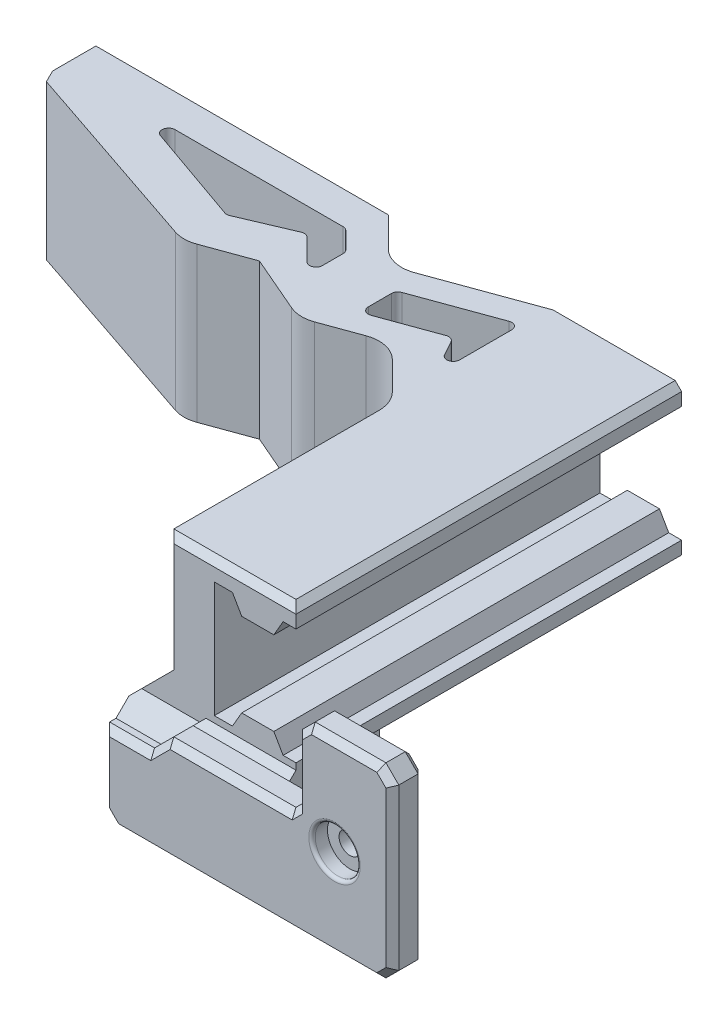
SolidWorks part; units mm, degrees
ref_plane "Płaszczyzna przednia" through (0, 0, 0) normal (0, 0, 1) x (1, 0, 0)
ref_plane "Płaszczyzna górna" through (0, 0, 0) normal (0, 1, 0) x (1, 0, 0)
ref_plane "Płaszczyzna prawa" through (0, 0, 0) normal (1, 0, 0) x (0, 0, -1)
sketch "Szkic1" plane through (0, 0, 0) normal (0, 0, 1) x (1, 0, 0)
  line L0 (11.0943, 9.0091) -> (9.0943, 9.0091)
  line L1 (-1.6107, -9.0091) -> (-1.6107, 9.0091)
  line L2 (-1.6107, 0) -> (0, 0) construction
  line L3 (1.2075, -9.0091) -> (1.2075, -4.43) construction
  line L4 (9.0943, -9.0091) -> (9.0943, -2.9466) construction
  line L5 (9.0943, 9.0091) -> (7.6509, 6.5091)
  line L6 (7.6509, 6.5091) -> (2.6509, 6.5091)
  line L7 (1.2075, -9.0091) -> (-1.6107, -9.0091)
  line L8 (2.6509, -6.5091) -> (1.2075, -9.0091)
  line L9 (7.6509, -6.5091) -> (2.6509, -6.5091)
  line L10 (9.0943, -9.0091) -> (7.6509, -6.5091)
  line L11 (11.0943, -9.0091) -> (9.0943, -9.0091)
  line L12 (11.0943, 9.0091) -> (11.0943, 12.0091)
  line L13 (2.6509, 6.5091) -> (1.2075, 9.0091)
  line L14 (11.0943, 12.0091) -> (-8.9057, 12.0091)
  line L15 (1.2075, 9.0091) -> (-1.6107, 9.0091)
  line L16 (9.0943, 9.0091) -> (9.0943, 2.9466) construction
  line L17 (1.2075, 9.0091) -> (1.2075, 4.43) construction
  line L18 (-8.9057, 12.0091) -> (-8.9057, -12.0091)
  line L19 (-8.9057, -12.0091) -> (11.0943, -12.0091)
  line L20 (11.0943, -9.0091) -> (11.0943, -12.0091)
  point P0 (0, 0)
  point P6 (0, 0)
  dimension "D1" = 2.5
  dimension "D2" = 3
  dimension "D3" = 2
  dimension "D4" = 30
  dimension "D5" = 30
  dimension "D6" = 5
  dimension "D7" = 2.5
  dimension "D8" = 3
  dimension "D9" = 20
extrude "Dodanie-wyciągnięcie1" add sketch "Szkic1" along normal blind 60
sketch "Szkic3" plane through (0, -12.0091, 0) normal (0, -1, 0) x (1, 0, 0)
  line L1 (-8.9057, 60) -> (-0.9057, 60)
  line L2 (-8.9057, 60) -> (-8.9057, 35)
  line L3 (-8.9057, 35) -> (-0.9057, 35)
  line L4 (-0.9057, 60) -> (-0.9057, 35)
  line L5 (-8.9057, 60) -> (-0.9057, 35) construction
  line L6 (-8.9057, 35) -> (-0.9057, 60) construction
  point P4 (-4.9057, 47.5)
  dimension "D1" = 8
  dimension "D2" = 25
extrude "Dodanie-wyciągnięcie3" add sketch "Szkic3" along normal blind 15
sketch "Szkic4" plane through (-8.9057, 0, 0) normal (-1, 0, 0) x (0, 0, 1)
  line L1 (60, -27.0091) -> (35, -27.0091)
  line L2 (60, -27.0091) -> (60, -12.0091)
  line L3 (60, -12.0091) -> (35, -12.0091)
  line L4 (35, -27.0091) -> (35, -12.0091)
  line L5 (60, -27.0091) -> (35, -12.0091) construction
  line L6 (60, -12.0091) -> (35, -27.0091) construction
  point P4 (47.5, -19.5091)
extrude "Dodanie-wyciągnięcie4" add sketch "Szkic4" along normal blind 5
chamfer "Sfazowanie1" distance 5 angle 45 2 edges
sketch "Szkic5" plane through (0, 0, 60) normal (0, 0, 1) x (1, 0, 0)
  line L1 (-13.9057, -27.0091) -> (31.0943, -27.0091)
  line L2 (-13.9057, -27.0091) -> (-13.9057, -14.0091)
  line L3 (-13.9057, -14.0091) -> (31.0943, -14.0091)
  line L4 (31.0943, -27.0091) -> (31.0943, -14.0091)
  line L5 (-13.9057, -27.0091) -> (31.0943, -14.0091) construction
  line L6 (-13.9057, -14.0091) -> (31.0943, -27.0091) construction
  point P4 (8.5943, -20.5091)
  dimension "D1" = 13
  dimension "D2" = 45
extrude "Dodanie-wyciągnięcie11" add sketch "Szkic5" along normal blind 5
sketch "Szkic7" plane through (0, -14.0091, 0) normal (0, 1, 0) x (1, 0, 0)
  line L0 (2.0943, -60) -> (-13.9057, -60) construction
  line L1 (31.0943, -65) -> (-3.9047, -65)
  line L2 (31.0943, -65) -> (31.0943, -60)
  line L3 (31.0943, -60) -> (-3.9047, -60)
  line L4 (-3.9047, -65) -> (-3.9047, -60)
  line L5 (31.0943, -65) -> (-3.9047, -60) construction
  line L6 (31.0943, -60) -> (-3.9047, -65) construction
  point P4 (13.5948, -62.5)
extrude "Dodanie-wyciągnięcie13" add sketch "Szkic7" along normal blind 3
sketch "Szkic8" plane through (0, -11.0091, 0) normal (0, 1, 0) x (1, 0, 0)
  line L0 (31.0943, -60) -> (11.0943, -60) construction
  line L1 (31.0943, -65) -> (16.0943, -65)
  line L2 (31.0943, -65) -> (31.0943, -60)
  line L3 (31.0943, -60) -> (16.0943, -60)
  line L4 (16.0943, -65) -> (16.0943, -60)
  line L5 (31.0943, -65) -> (16.0943, -60) construction
  line L6 (31.0943, -60) -> (16.0943, -65) construction
  point P4 (23.5943, -62.5)
  dimension "D1" = 15
extrude "Dodanie-wyciągnięcie14" add sketch "Szkic8" along normal blind 13
chamfer "Sfazowanie2" distance 3 angle 45 2 edges at (-3.9047, -14.0091, 62.5)
chamfer "Sfazowanie3" distance 1 angle 45 1 edges at (16.0943, -11.0091, 62.5)
chamfer "Sfazowanie4" distance 2 angle 45 4 edges at (-13.9057, -27.0091, 50) (31.0943, -27.0091, 62.5) (31.0943, 1.9909, 62.5) (16.0943, 1.9909, 62.5)
chamfer "Sfazowanie5" distance 3 angle 45 1 edges
chamfer "Sfazowanie6" distance 1 angle 45 1 edges at (3.5948, -11.0091, 60)
chamfer "Sfazowanie7" distance 1 angle 45 2 edges
chamfer "Sfazowanie8" distance 1 angle 45 4 edges at (11.0943, -12.0091, 28.5) (11.0943, 12.0091, 30) (1.0943, 12.0091, 60)
chamfer "Sfazowanie9" distance 1 angle 45 18 edges at (-11.9057, -10.0091, 35) (-13.9057, -18.5091, 35) (-12.9057, -26.0091, 35) (-6.4057, -27.0091, 35) (-12.9057, -26.0091, 65) (8.5943, -27.0091, 65) (30.0943, -26.0091, 65) (-13.9057, -19.5091, 65) (-10.4052, -14.0091, 65) (-5.4047, -12.5091, 65) (5.5948, -11.0091, 65) (15.5943, -10.5091, 65) (16.0943, -5.0091, 65) (17.0943, 0.9909, 65) (23.5943, 1.9909, 65) (30.0943, 0.9909, 65) (31.0943, -12.5091, 65)
chamfer "Sfazowanie10" distance 1 angle 45 11 edges at (0.0943, -16.0091, 60) (30.0943, -26.0091, 60) (31.0943, -12.5091, 60) (30.0943, 0.9909, 60) (13.0943, -11.0091, 60) (15.5943, -10.5091, 60) (16.0943, -5.0091, 60) (17.0943, 0.9909, 60) (23.5943, 1.9909, 60)
sketch "Szkic9" plane through (0, 0, 65) normal (0, 0, 1) x (1, 0, 0)
  line L0 (-11.4915, -26.0091) -> (28.68, -26.0091) construction
  line L1 (30.0943, -24.5949) -> (30.0943, -0.4233) construction
  point P0 (22.0943, -13.0091)
  dimension "D1" = 13
  dimension "D2" = 8
hole_wizard "Pogłębienie walcowe pod M3 Śrubę z łbem stożkowym ściętym1" positions "Szkic 3D1" profile "Szkic10" counterbore size "M3" standard "ISO"
sketch3d "Szkic 3D1"
  point P0 (22.0943, -13.0091, 65)
sketch "Szkic10" plane through (22.0943, -13.0091, 65) normal (1, 0, 0) x (0, -1, 0)
  line L0 (0, 0) -> (0, 5)
  line L1 (0, 5) -> (1.7, 5)
  line L3 (1.7, 5) -> (1.7, 2.4)
  line L4 (1.7, 2.4) -> (3.5, 2.4)
  line L5 (3.5, 2.4) -> (3.5, 0)
  line L7 (3.5, 0) -> (0, 0)
  line L11 (0, -6.35) -> (0, 107.95) construction
  dimension "Średnica otworu na wylot" = 3.4
  dimension "Głębokość otworu na wylot" = 5
  dimension "Średnica pogłębienia walcowego" = 7
  dimension "Głębokość pogłębienia walcowego" = 2.4
fillet "Zaokrąglenie1" radius 0.5 1 edges at (25.5943, -13.0091, 65)
sketch "Szkic11" plane through (0, 12.0091, 0) normal (0, 1, 0) x (1, 0, 0)
  line L0 (-8.9057, 0) -> (-27.6996, -6.8404)
  line L1 (-8.9057, 0) -> (-71.8898, 0) construction
  line L2 (-8.9057, -14) -> (-27.6996, -20.8404)
  line L3 (-8.9057, -59) -> (-8.9057, 0) construction
  line L4 (-8.9057, 0) -> (-8.9057, -14)
  line L5 (-27.6996, -6.8404) -> (-27.6996, -20.8404)
  dimension "D1" = 20
  dimension "D2" = 20
  dimension "D3" = 20
  dimension "D4" = 14
  dimension "D5" = 14
extrude "Dodanie-wyciągnięcie15" add sketch "Szkic11" against normal up to surface (24.0182 mm away)
chamfer "Sfazowanie11" distance 11 angle 45 1 edges at (-8.9057, 0, 14)
sketch "Szkic12" plane through (0, 12.0091, 0) normal (0, 1, 0) x (1, 0, 0)
  line L0 (-23.6996, -9.6412) -> (-9.4416, -4.4517)
  line L1 (-23.6996, -9.6412) -> (-23.6996, -15.3811)
  line L2 (-23.6996, -15.3811) -> (-12.9704, -11.476)
  line L3 (-27.6996, -6.8404) -> (-27.6996, -20.8404) construction
  line L4 (-12.9704, -11.476) -> (-9.4416, -17.8728)
  line L5 (-8.9057, 0) -> (-27.6996, -6.8404) construction
  line L8 (-9.4416, -17.8728) -> (-9.4416, -4.4517)
  point P4 (-27.6996, -13.8404)
  dimension "D1" = 4
  dimension "D2" = 4
  dimension "D3" = 4
extrude "Wytnij-wyciągnięcie1" cut sketch "Szkic12" against normal through all
fillet "Zaokrąglenie2" radius 1 5 edges at (-23.6996, 0, 15.3811) (-23.6996, 0, 9.6412) (-12.9704, 0, 11.476) (-9.4416, 0, 17.8728) (-9.4416, 0, 4.4517)
sketch "Szkic13" plane through (0, 12.0091, 0) normal (0, 1, 0) x (1, 0, 0)
  line L0 (10.0943, 0) -> (-8.9057, 0) construction
  line L1 (-8.9057, 0) -> (-71.8166, 0) construction
  line L2 (-27.6996, -6.8404) -> (-34.54, 0)
  line L3 (-34.54, 0) -> (-80.0362, 0)
  line L4 (-80.0362, 0) -> (-80.0362, -8.3277)
  line L5 (-80.0362, -8.3277) -> (-47.137, -19.4374)
  line L6 (-47.137, -19.4374) -> (-38.3512, -16.2397)
  line L7 (-38.3512, -16.2397) -> (-27.6996, -20.8404)
  line L8 (-32.8258, -8.3277) -> (-36.0435, -5.1101)
  line L9 (-36.0435, -5.1101) -> (-68.4975, -5.1101)
  line L10 (-68.4975, -5.1101) -> (-47.137, -12.59)
  line L11 (-47.137, -12.59) -> (-38.3512, -8.85)
  line L12 (-38.3512, -8.85) -> (-32.8258, -14.3754)
  line L13 (-32.8258, -14.3754) -> (-32.8258, -8.3277)
extrude "Dodanie-wyciągnięcie16" add sketch "Szkic13" against normal up to surface (24.0182 mm away) contours L6 L7 L2 L3 L4 L5 L13 L12 L11 L10 L9 L8 M15
fillet "Zaokrąglenie3" radius 1 6 edges at (-47.137, 0, 12.59) (-68.4975, 0, 5.1101) (-36.0435, 0, 5.1101) (-32.8258, 0, 8.3277) (-32.8258, 0, 14.3754) (-38.3512, 0, 8.85)
fillet "Zaokrąglenie4" radius 5 5 edges at (-27.6996, 0, 6.8404) (-8.9057, 0, 25) (-16.9704, 0, 16.9353) (-27.6996, 0, 20.8404) (-47.137, 0, 19.4374)
chamfer "Sfazowanie12" distance 1 angle 45 1 edges at (-80.0362, 0, 8.3277)
sketch "Szkic14" plane through (0, 0, 0) normal (0, 0, -1) x (-1, 0, 0)
  line L0 (80.0362, 0) -> (61.4934, 0) construction
  line L1 (80.0362, -12.0091) -> (80.0362, 12.0091) construction
  line L3 (65.0362, 5) -> (75.0362, 5)
  line L4 (65.0362, 5) -> (65.0362, -5)
  line L5 (65.0362, -5) -> (75.0362, -5)
  line L6 (75.0362, 5) -> (75.0362, -5)
  line L7 (65.0362, 5) -> (75.0362, -5) construction
  line L8 (65.0362, -5) -> (75.0362, 5) construction
  point P5 (70.0362, 0)
  dimension "D1" = 10
  dimension "D2" = 10
  dimension "D3" = 10
extrude "Wytnij-wyciągnięcie2" cut sketch "Szkic14" against normal blind 5
